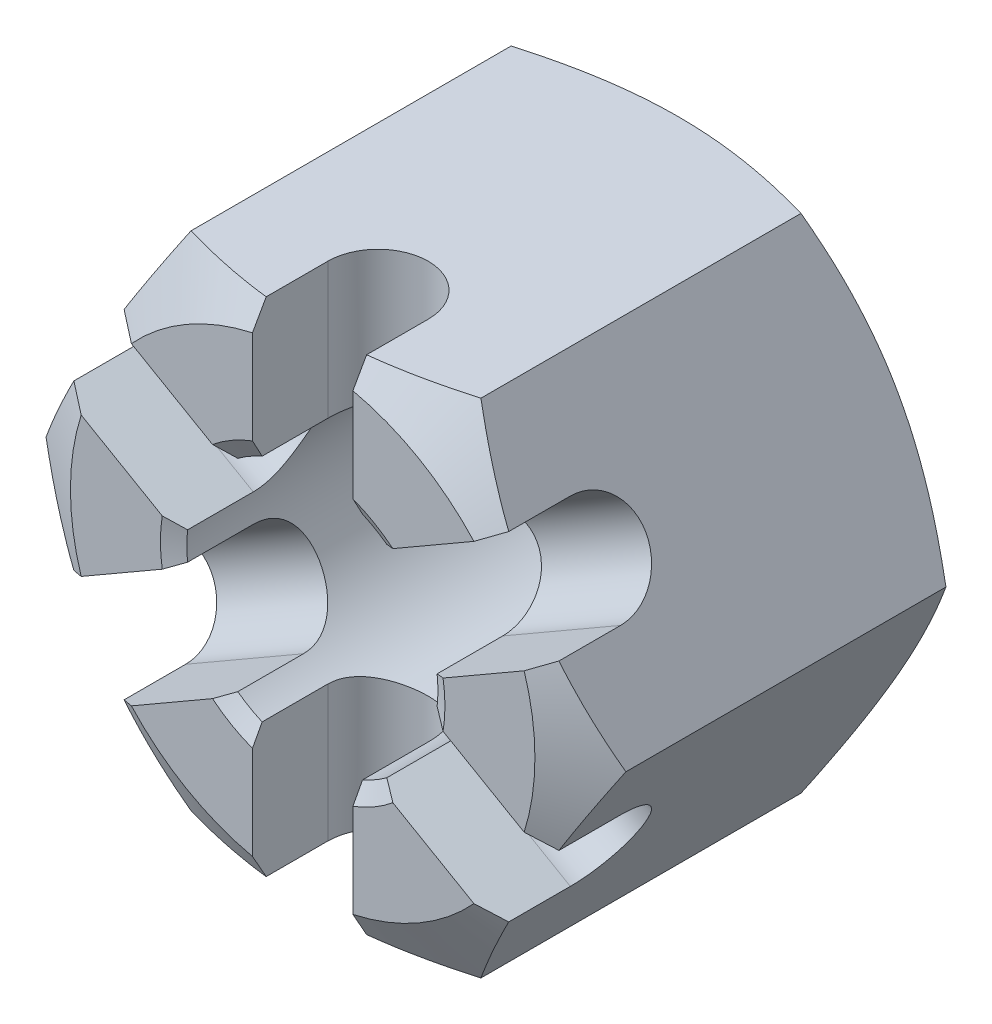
SolidWorks part; units mm, degrees
ref_plane "Front" through (0, 0, 0) normal (0, 0, 1) x (1, 0, 0)
ref_plane "Top" through (0, 0, 0) normal (0, 1, 0) x (1, 0, 0)
ref_plane "Right" through (0, 0, 0) normal (1, 0, 0) x (0, 0, -1)
other "Configuration Table"
sketch "Sketch1" plane through (0, 0, 0) normal (0, 0, 1) x (1, 0, 0)
  line L1 (2.8868, -5) -> (5.7735, 0)
  line L2 (5.7735, 0) -> (2.8868, 5)
  line L3 (2.8868, 5) -> (-2.8868, 5)
  line L4 (-2.8868, 5) -> (-5.7735, 0)
  line L5 (-5.7735, 0) -> (-2.8868, -5)
  line L6 (-2.8868, -5) -> (2.8868, -5)
  circle A0 centre (0, 0) radius 5 construction
  circle A1 centre (0, 0) radius 2.5
extrude "BaseNut" add sketch "Sketch1" against normal blind 7.7
sketch "Sketch2" plane through (0, 0, 0) normal (0, 1, 0) x (1, 0, 0)
  line L0 (-5.7735, 7.7) -> (-4.625, 7.7)
  line L2 (-4.625, 7.7) -> (-5.7735, 7.0369)
  line L3 (-5.7735, 7.0369) -> (-5.7735, 7.7)
  line L4 (0, 3.3759) -> (0, -9.8171) construction
  line L6 (-9.7712, 3.85) -> (9.8853, 3.85) construction
  line L7 (-5.7735, 0.6631) -> (-5.7735, 0)
  line L8 (-4.625, 0) -> (-5.7735, 0.6631)
  line L9 (-5.7735, 0) -> (-4.625, 0)
revolve "Double-Chamfer" cut sketch "Sketch2" angle 360 about L4
chamfer "EndChamfer" distance 0.3333 angle 30 2 edges at (2.5, 0, -7.7) (2.5, 0, 0)
sketch "Sketch3" plane through (0, 0, 0) normal (0, 1, 0) x (1, 0, 0)
  line L0 (0, 4.2201) -> (0, -10.5237) construction
  line L2 (-1, 0) -> (-1, 1.5)
  line L3 (1, 0) -> (1, 1.5)
  line L4 (2.6925, 7.7) -> (-2.6925, 7.7) construction
  arc A0 (-1, 1.5) -> (1, 1.5) centre (0, 1.5) cw
  point P2 (0, 2.5)
  point P3 (0, 7.7)
  dimension "W" = 5.2
  dimension "n" = 2
extrude "Slot" cut sketch "Sketch3" against normal through all and the other way through all
ref_axis "Axis1" through (0, 0, 9.8171) along (0, 0, -1)
pattern_circular "SlotPattern" count 3 over 360 about axis through (0, 0, 9.8171) along (0, 0, -1) of "Slot"
sketch "Sketch4" plane through (0, 0, 0) normal (0, 1, 0) x (1, 0, 0)
  line L0 (0, 9.27) -> (0, 5.1988) construction
  line L1 (2, 7.6167) -> (2.5, 7.6167)
  line L2 (2.5, 7.6167) -> (2.933, 7.3667)
  line L3 (2.933, 7.3667) -> (2.5, 7.1167)
  line L4 (2.5, 7.1167) -> (2, 7.1167)
  line L5 (2, 7.1167) -> (2, 7.6167)
  line L7 (2.5, 7.3667) -> (-2.5, 7.3667) construction
revolve "Cut-Revolve10" [suppressed] cut sketch "Sketch4" angle 360 about L0
pattern_linear "LPattern10" [suppressed] count 13 spacing 0.6 along (0, 0, 1)
equation "\"dw@Sketch2\" = \"s@Sketch1\"-0.75"
equation "\"D2@Sketch2\" = \"m@BaseNut\" / 2"
equation "\"D1@EndChamfer\" = \"D@Sketch1\" / 15"
equation "\"D2@Sketch4\" = \"D@Sketch1\""
equation "\"D1@Sketch4\" = (  \"D@ThreadCosmetic1\" - \"D@Sketch1\" )  / 2"
equation "\"D3@LPattern10\" = \"D1@Sketch4\" * 1.2"
equation "\"D1@LPattern10\" =  \"m@BaseNut\"   / \"D3@LPattern10\""
